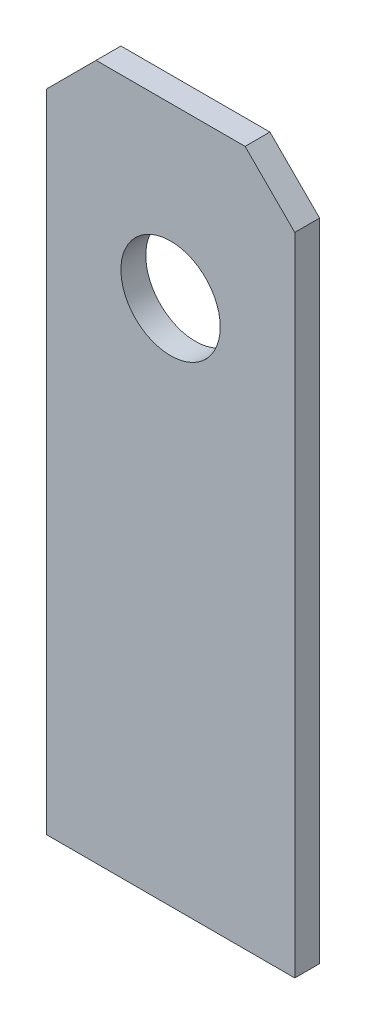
SolidWorks part; units mm, degrees
ref_plane "Plan de face" through (0, 0, 0) normal (0, 0, 1) x (1, 0, 0)
ref_plane "Plan de dessus" through (0, 0, 0) normal (0, 1, 0) x (1, 0, 0)
ref_plane "Plan de droite" through (0, 0, 0) normal (1, 0, 0) x (0, 0, -1)
sketch "Esquisse1" plane through (0, 0, 0) normal (0, 0, 1) x (1, 0, 0)
  line L1 (0, 0) -> (50, 0)
  line L2 (0, 0) -> (0, 140)
  line L3 (0, 140) -> (50, 140)
  line L4 (50, 0) -> (50, 140)
  circle A0 centre (25, 106) radius 10
  dimension "D3" = 20
  dimension "D4" = 106
  dimension "D5" = 25
  dimension "D1" = 50
  dimension "D2" = 140
extrude "Extrusion1" add sketch "Esquisse1" along normal blind 5
chamfer "Chanfrein1" distance 10 angle 45 2 edges at (0, 140, 2.5) (50, 140, 2.5)
